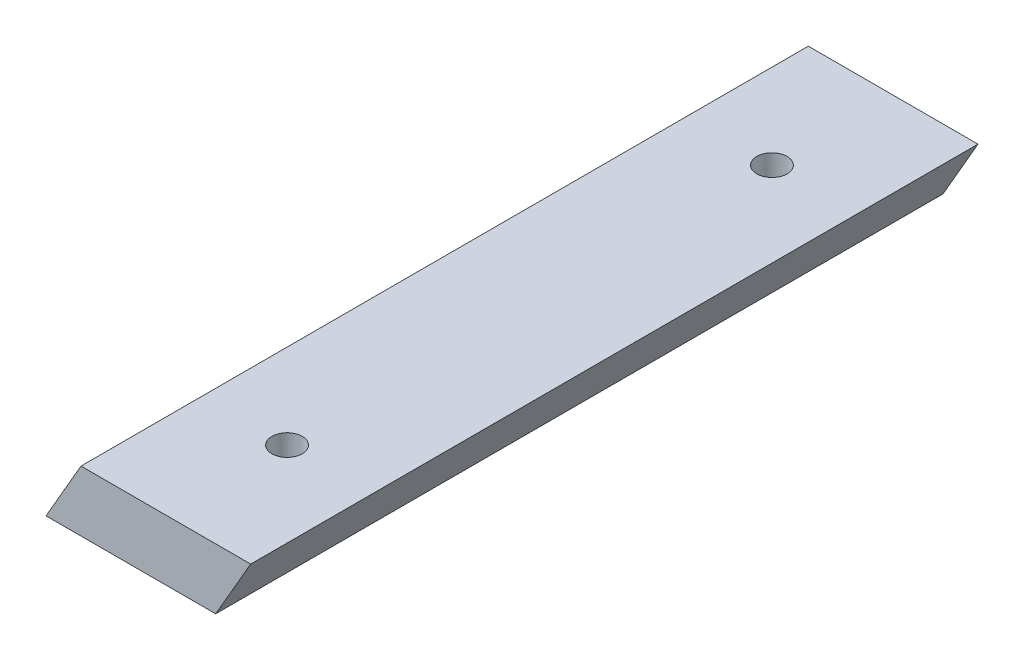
SolidWorks part; units mm, degrees
ref_plane "Front Plane" through (0, 0, 0) normal (0, 0, 1) x (1, 0, 0)
ref_plane "Top Plane" through (0, 0, 0) normal (0, 1, 0) x (1, 0, 0)
ref_plane "Right Plane" through (0, 0, 0) normal (1, 0, 0) x (0, 0, -1)
sketch "Sketch1" plane through (0, 0, 0) normal (0, 0, 1) x (1, 0, 0)
  line L0 (14, 5) -> (8.2265, -5)
  line L1 (14, -5) -> (-14, -5)
  line L2 (14, -5) -> (14, 5)
  line L3 (14, 5) -> (-14, 5)
  line L4 (-14, -5) -> (-14, 5)
  line L5 (14, -5) -> (-14, 5) construction
  line L6 (14, 5) -> (-14, -5) construction
  line L7 (-14, 5) -> (-19.7735, -5)
  line L8 (-19.7735, -5) -> (-14, -5)
  point P0 (0, 0)
  dimension "D1" = 10
  dimension "D2" = 28
  dimension "D3" = 120
extrude "Boss-Extrude1" add sketch "Sketch1" along normal mid plane 120 contours L7 L8 L4 | L4 L1 L0 L3
sketch "Sketch2" plane through (0, 5, 0) normal (0, 1, 0) x (1, 0, 0)
  line L1 (0, -40) -> (0, -60) construction
  line L2 (14, -60) -> (-14, -60) construction
  circle A0 centre (0, -40) radius 2.5
  dimension "D1" = 5
  dimension "D2" = 20
extrude "Cut-Extrude1" cut sketch "Sketch2" against normal through all
mirror "Mirror1" about plane through (0, 0, 0) normal (0, 0, 1) of "Cut-Extrude1"
